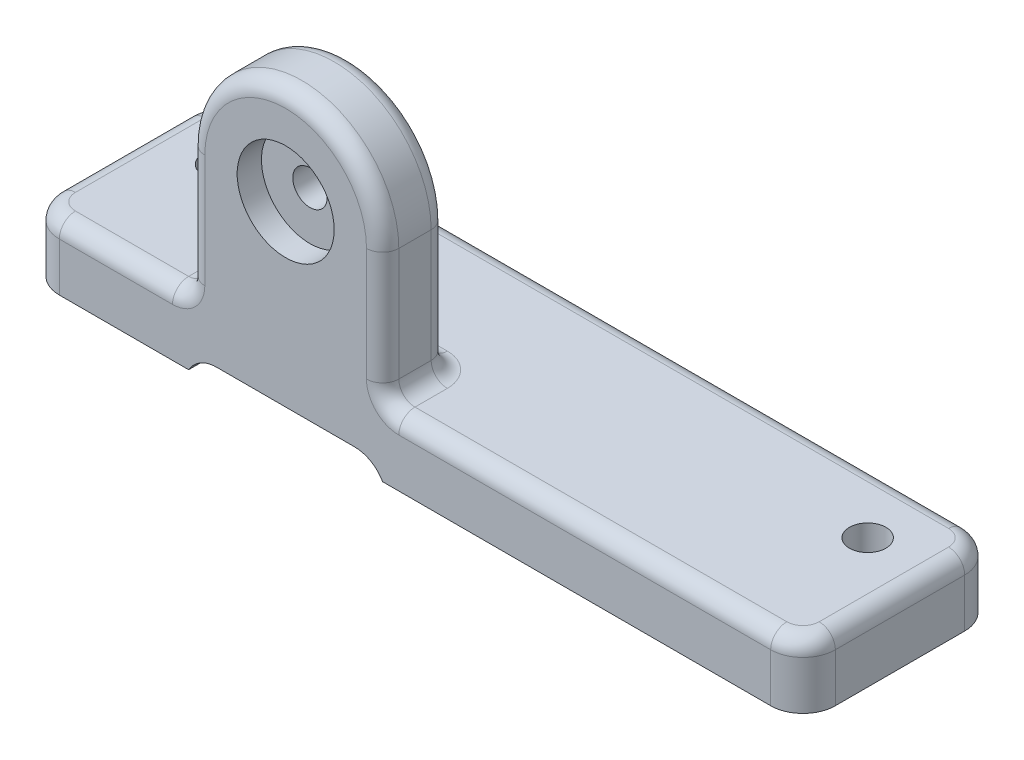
SolidWorks part; units mm, degrees
ref_plane "Front Plane" through (0, 0, 0) normal (0, 0, 1) x (1, 0, 0)
ref_plane "Top Plane" through (0, 0, 0) normal (0, 1, 0) x (1, 0, 0)
ref_plane "Right Plane" through (0, 0, 0) normal (1, 0, 0) x (0, 0, -1)
sketch "Sketch1" plane through (0, 0, 0) normal (0, 1, 0) x (1, 0, 0)
  line L1 (0, 0) -> (152.4, 0)
  line L2 (0, 0) -> (0, 38.1)
  line L3 (0, 38.1) -> (152.4, 38.1)
  line L4 (152.4, 0) -> (152.4, 38.1)
  dimension "D1" = 152.4
  dimension "D2" = 38.1
extrude "BasePlate" add sketch "Sketch1" along normal blind 12.7
sketch "Sketch2" plane through (0, 0, 0) normal (0, 0, 1) x (1, 0, 0)
  line L0 (31.75, 0) -> (31.75, 38.1)
  line L1 (0, 0) -> (152.4, 0) construction
  line L2 (69.85, 0) -> (69.85, 38.1)
  line L3 (69.85, 0) -> (31.75, 0)
  line L4 (0, 12.7) -> (0, 0) construction
  arc A0 (31.75, 38.1) -> (69.85, 38.1) centre (50.8, 38.1) cw
  dimension "D2" = 50.8
  dimension "D3" = 19.05
  dimension "D1" = 38.1
extrude "VertBoss" add sketch "Sketch2" against normal blind 12.7
hole_wizard "CBORE for 1/4 Hex Head Bolt1" positions "Sketch4" profile "Sketch3" counterbore size "1/4" standard "Ansi Inch"
sketch "Sketch4" plane through (0, 0, 0) normal (0, 0, 1) x (1, 0, 0)
  point P0 (50.8, 38.1)
sketch "Sketch3" plane through (50.8, 38.1, 0) normal (1, 0, 0) x (0, -1, 0)
  line L0 (0, 0) -> (0, 38.1)
  line L1 (0, 38.1) -> (3.3782, 38.1)
  line L3 (3.3782, 38.1) -> (3.3782, 4.7752)
  line L4 (3.3782, 4.7752) -> (9.525, 4.7752)
  line L5 (9.525, 4.7752) -> (9.525, 0)
  line L7 (9.525, 0) -> (0, 0)
  line L11 (0, -6.35) -> (0, 107.95) construction
  dimension "Thru Hole Dia." = 6.7564
  dimension "Thru Hole Depth" = 38.1
  dimension "C'Bore Dia." = 19.05
  dimension "C'Bore Depth" = 4.7752
sketch "Sketch5" plane through (0, 0, 0) normal (0, 0, 1) x (1, 0, 0)
  line L0 (0, 0) -> (152.4, 0) construction
  line L1 (31.75, 0) -> (69.85, 0)
  line L2 (31.75, 0) -> (31.75, 3.175)
  line L3 (31.75, 3.175) -> (69.85, 3.175)
  line L4 (69.85, 0) -> (69.85, 3.175)
  line L5 (69.85, 12.7) -> (69.85, 38.1) construction
  line L6 (31.75, 38.1) -> (31.75, 12.7) construction
  dimension "D1" = 3.175
extrude "BottomSlot" cut sketch "Sketch5" against normal through all
hole_wizard "9/32 (0.28125) Diameter Hole1" positions "Sketch7" profile "Sketch6" hole size "9/32" standard "Ansi Inch"
sketch "Sketch7" plane through (0, 12.7, 0) normal (0, 1, 0) x (-1, 0, 0)
  line L0 (-152.4, 0) -> (-152.4, -38.1) construction
  line L1 (-152.4, -38.1) -> (0, -38.1) construction
  line L2 (0, -38.1) -> (0, 0) construction
  point P0 (-139.7, -25.4)
  point P1 (-12.7, -25.4)
  dimension "D1" = 12.7
  dimension "D2" = 12.7
  dimension "D3" = 12.7
sketch "Sketch6" plane through (139.7, 12.7, -25.4) normal (1, 0, 0) x (0, 0, 1)
  line L0 (0, 0) -> (0, 12.7)
  line L1 (0, 12.7) -> (3.5719, 12.7)
  line L2 (3.5719, 12.7) -> (3.5719, 0)
  line L5 (3.5719, 0) -> (0, 0)
  line L11 (0, -6.35) -> (0, 107.95) construction
  dimension "Thru Hole Dia." = 7.1437
  dimension "Thru Hole Depth" = 12.7
fillet "Fillet1" radius 6.35 6 edges at (152.4, 6.35, -38.1) (152.4, 6.35, 0) (69.85, 3.175, -19.05) (31.75, 3.175, -19.05) (0, 6.35, -38.1) (0, 6.35, 0)
fillet "Fillet2" radius 3.175 18 edges at (1.8599, 12.7, -36.2401) (0, 12.7, -19.05) (76.2, 12.7, -38.1) (1.8599, 12.7, -1.8599) (150.5401, 12.7, -36.2401) (19.05, 12.7, 0) (152.4, 12.7, -19.05) (31.75, 12.7, -6.35) (150.5401, 12.7, -1.8599) (50.8, 12.7, -12.7) (107.95, 12.7, 0) (31.75, 25.4, -12.7) (50.8, 57.15, -12.7) (31.75, 25.4, 0) (50.8, 57.15, 0) (69.85, 12.7, -6.35) (69.85, 25.4, -12.7) (69.85, 25.4, 0)
